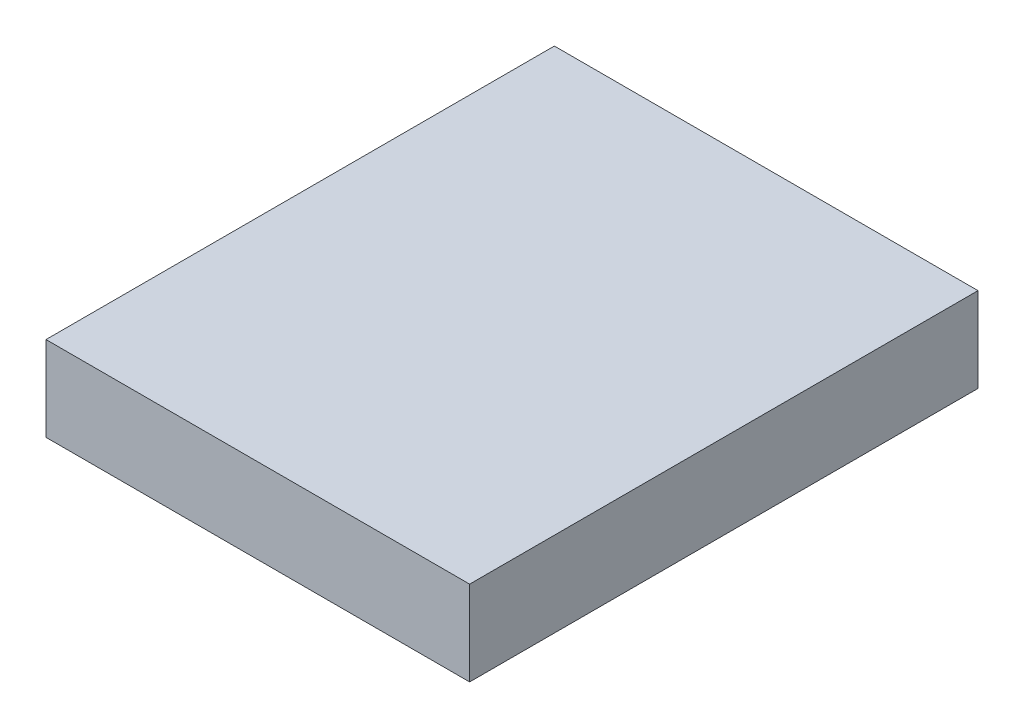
SolidWorks part; units mm, degrees
ref_plane "Front Plane" through (0, 0, 0) normal (0, 0, 1) x (1, 0, 0)
ref_plane "Top Plane" through (0, 0, 0) normal (0, 1, 0) x (1, 0, 0)
ref_plane "Right Plane" through (0, 0, 0) normal (1, 0, 0) x (0, 0, -1)
sketch "Sketch1" plane through (0, 0, 0) normal (0, 1, 0) x (1, 0, 0)
  line L0 (-127, -152.4) -> (127, 152.4) construction
  line L1 (-127, 152.4) -> (127, 152.4)
  line L2 (-127, 152.4) -> (-127, -152.4)
  line L3 (-127, -152.4) -> (127, -152.4)
  line L4 (127, 152.4) -> (127, -152.4)
  dimension "D1" = 254
  dimension "D2" = 304.8
extrude "Extrude1" add sketch "Sketch1" along normal blind 50.8
